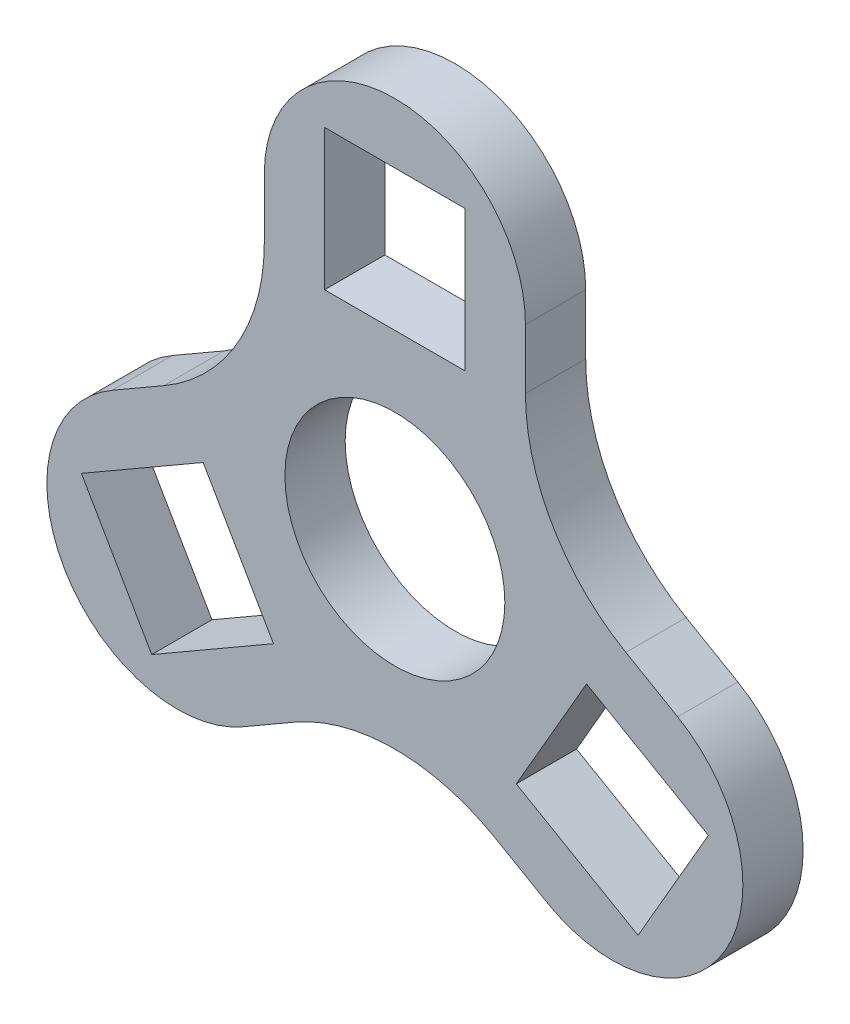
SolidWorks part; units mm, degrees
ref_plane "Plan de face" through (0, 0, 0) normal (0, 0, 1) x (1, 0, 0)
ref_plane "Plan de dessus" through (0, 0, 0) normal (0, 1, 0) x (1, 0, 0)
ref_plane "Plan de droite" through (0, 0, 0) normal (1, 0, 0) x (0, 0, -1)
sketch "Esquisse1" plane through (0, 0, 0) normal (0, 0, 1) x (1, 0, 0)
  line L0 (0, 0) -> (0, 41.5934) construction
  line L1 (24.2128, -22.0622) -> (12.0885, -15.0622)
  line L2 (-7, 32) -> (7, 32)
  line L3 (-7, 32) -> (-7, 18)
  line L4 (-7, 18) -> (7, 18)
  line L5 (7, 32) -> (7, 18)
  line L6 (-7, 32) -> (7, 18) construction
  line L7 (-7, 18) -> (7, 32) construction
  line L8 (19.0885, -2.9378) -> (12.0885, -15.0622)
  line L9 (31.2128, -9.9378) -> (19.0885, -2.9378)
  line L10 (31.2128, -9.9378) -> (24.2128, -22.0622)
  line L11 (-31.2128, -9.9378) -> (-19.0885, -2.9378)
  line L12 (-12.0885, -15.0622) -> (-19.0885, -2.9378)
  line L13 (-24.2128, -22.0622) -> (-12.0885, -15.0622)
  line L14 (-24.2128, -22.0622) -> (-31.2128, -9.9378)
  line L15 (-13, 25) -> (13, 25) construction
  line L16 (13, 25) -> (13, 7.5056)
  line L17 (-13, 25) -> (-13, 7.5056)
  line L18 (28.1506, -1.2417) -> (13, 7.5056)
  line L19 (15.1506, -23.7583) -> (0, -15.0111)
  line L20 (-15.1506, -23.7583) -> (0, -15.0111)
  line L21 (-28.1506, -1.2417) -> (-13, 7.5056)
  circle A0 centre (0, 0) radius 10.95
  circle A1 centre (0, 0) radius 25 construction
  arc A3 (13, 25) -> (-13, 25) centre (0, 25) ccw
  arc A4 (15.1506, -23.7583) -> (28.1506, -1.2417) centre (21.6506, -12.5) ccw
  arc A5 (-28.1506, -1.2417) -> (-15.1506, -23.7583) centre (-21.6506, -12.5) ccw
  point P4 (0, 25)
  point P20 (0, 0)
  point P36 (0, 0)
  dimension "D1" = 21.9
  dimension "D2" = 50
  dimension "D6" = 26
  dimension "D3" = 14
  dimension "D4" = 14
  dimension "D7" = 3
  dimension "D5" = 3
extrude "Boss.-Extru.1" add sketch "Esquisse1" along normal mid plane 6
fillet "Congé1" radius 20 3 edges at (-13, 7.5056, 0) (0, -15.0111, 0) (13, 7.5056, 0)
sketch "Esquisse2" plane through (0, 0, 3) normal (0, 0, 1) x (1, 0, 0)
  line L0 (0, 0) -> (0, 32) construction
  line L1 (7, 32) -> (-7, 32) construction
  line L2 (0, 0) -> (27.7128, -16) construction
  line L3 (24.2128, -22.0622) -> (31.2128, -9.9378) construction
  line L4 (0, 0) -> (-27.7128, -16) construction
  line L5 (-31.2128, -9.9378) -> (-24.2128, -22.0622) construction
